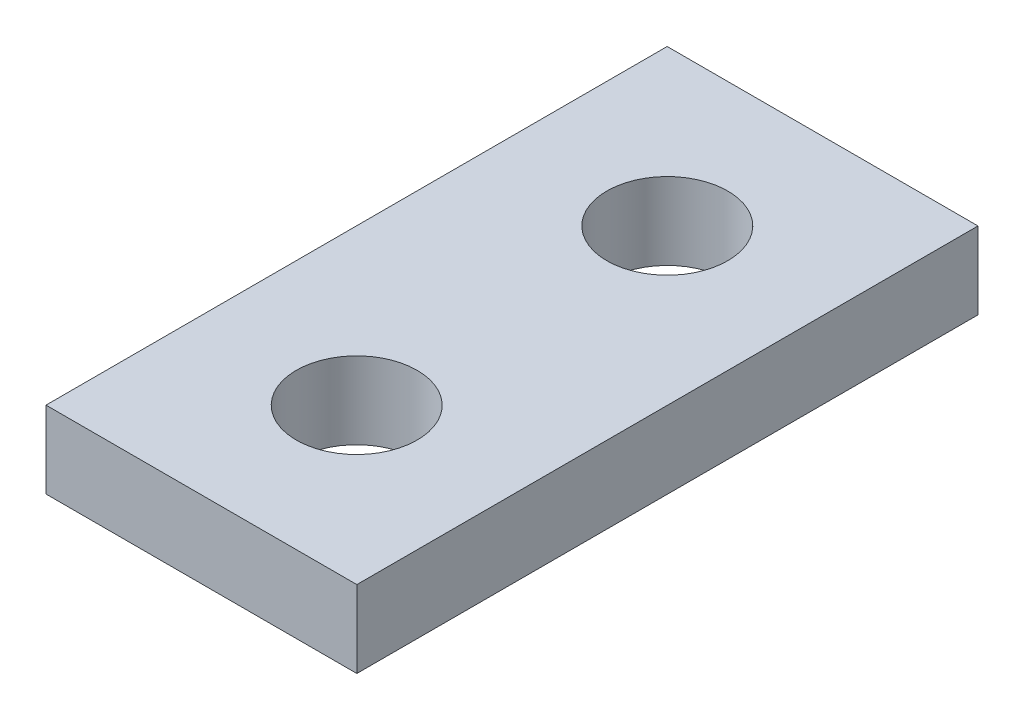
SolidWorks part; units mm, degrees
ref_plane "Front Plane" through (0, 0, 0) normal (0, 0, 1) x (1, 0, 0)
ref_plane "Top Plane" through (0, 0, 0) normal (0, 1, 0) x (1, 0, 0)
ref_plane "Right Plane" through (0, 0, 0) normal (1, 0, 0) x (0, 0, -1)
sketch "Sketch1" plane through (0, 0, 0) normal (0, 1, 0) x (1, 0, 0)
  line L1 (-4.7663, -9.525) -> (4.7663, -9.525)
  line L2 (-4.7663, -9.525) -> (-4.7663, 9.525)
  line L3 (-4.7663, 9.525) -> (4.7663, 9.525)
  line L4 (4.7663, -9.525) -> (4.7663, 9.525)
  line L5 (-4.7663, -9.525) -> (4.7663, 9.525) construction
  line L6 (-4.7663, 9.525) -> (4.7663, -9.525) construction
  point P0 (0, 0)
  dimension "D1" = 19.05
  dimension "D2" = 9.5326
extrude "Boss-Extrude1" add sketch "Sketch1" along normal blind 2.3622
sketch "Sketch2" plane through (0, 2.3622, 0) normal (0, 1, 0) x (1, 0, 0)
  line L0 (0, 0) -> (0, 15.3123) construction
  line L1 (0, 0) -> (-18.395, 0) construction
  circle A0 centre (0, 4.7625) radius 1.8542
  circle A1 centre (0, -4.7625) radius 1.8542
  dimension "D1" = 3.7084
  dimension "D2" = 9.525
extrude "Cut-Extrude1" cut sketch "Sketch2" against normal through all
